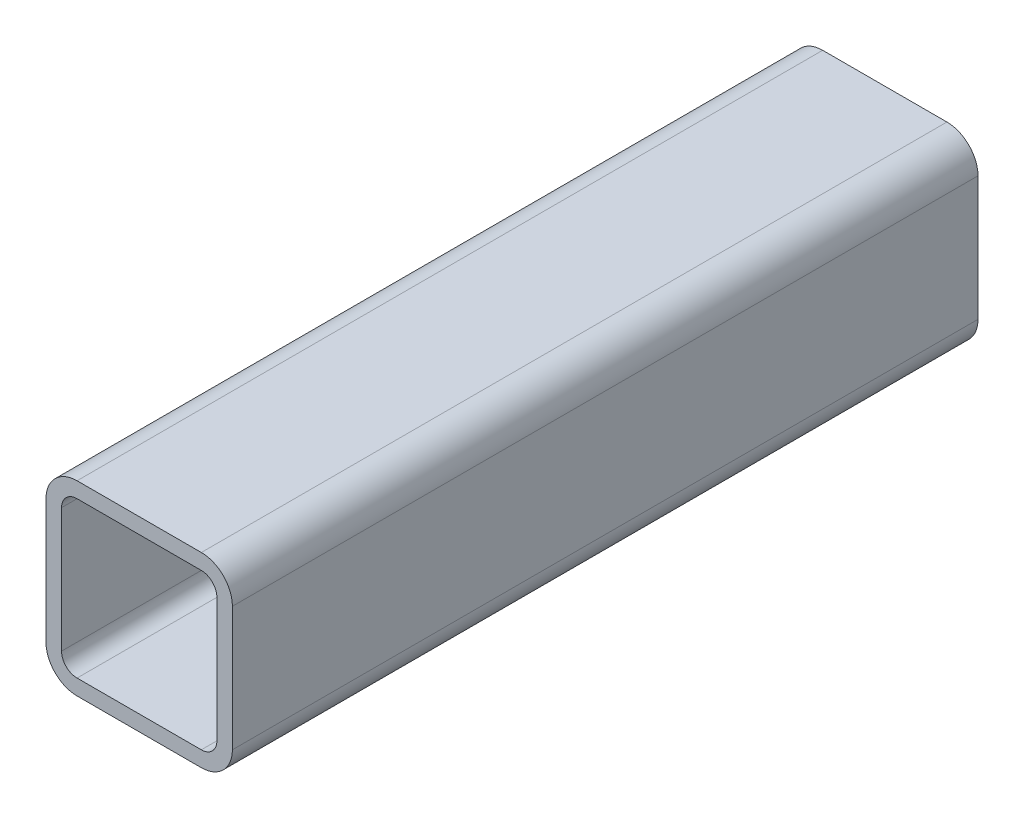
SolidWorks part; units mm, degrees
ref_plane "Front Plane" through (0, 0, 0) normal (0, 0, 1) x (1, 0, 0)
ref_plane "Top Plane" through (0, 0, 0) normal (0, 1, 0) x (1, 0, 0)
ref_plane "Right Plane" through (0, 0, 0) normal (1, 0, 0) x (0, 0, -1)
sketch "Sketch1" plane through (0, 0, 0) normal (0, 0, 1) x (1, 0, 0)
sketch_block_instance "HSS3x3x0.250-1"
sketch_block "HSS3x3x0.250"
extrude "Boss-Extrude1" add sketch "Sketch1" along normal blind 304.8
